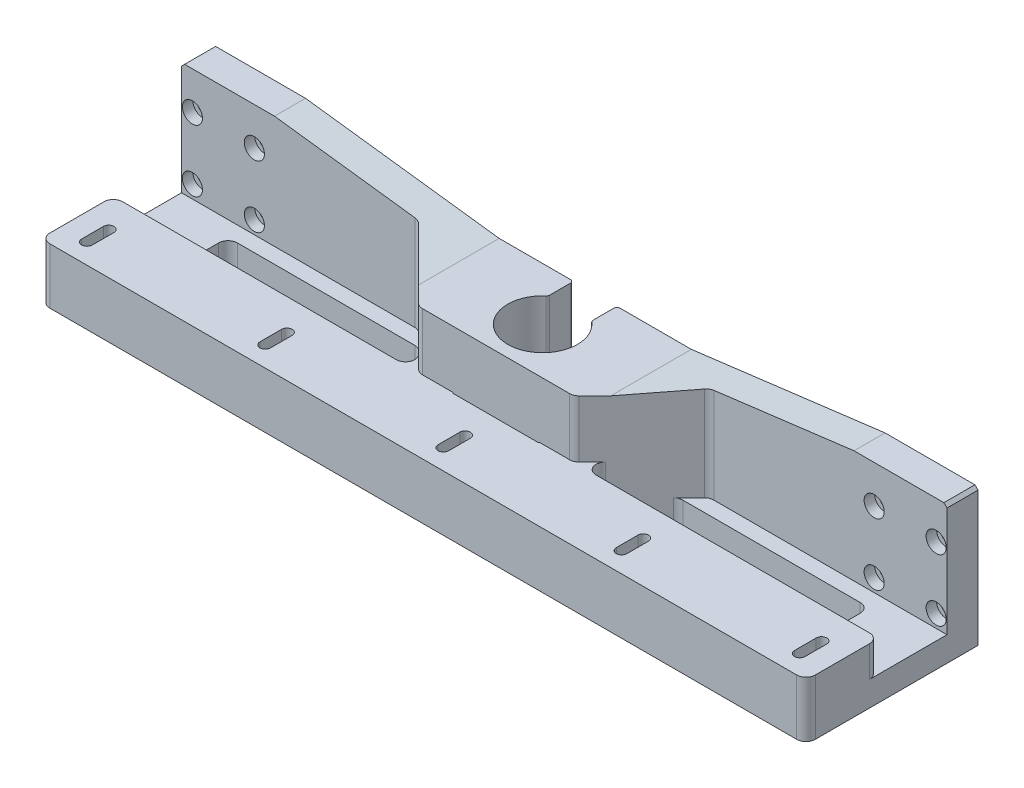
SolidWorks part; units mm, degrees
ref_plane "Ebene vorne" through (0, 0, 0) normal (0, 0, 1) x (1, 0, 0)
ref_plane "Ebene oben" through (0, 0, 0) normal (0, 1, 0) x (1, 0, 0)
ref_plane "Ebene rechts" through (0, 0, 0) normal (1, 0, 0) x (0, 0, -1)
sketch "Skizze1" plane through (0, 0, 0) normal (0, 0, 1) x (1, 0, 0)
  line L1 (-123.5, -22.2) -> (123.5, -22.2)
  line L2 (-123.5, -22.2) -> (-123.5, 22.2)
  line L3 (-123.5, 22.2) -> (123.5, 22.2)
  line L4 (123.5, -22.2) -> (123.5, 22.2)
  line L5 (-123.5, -22.2) -> (123.5, 22.2) construction
  line L6 (-123.5, 22.2) -> (123.5, -22.2) construction
  point P0 (0, 0)
  dimension "D1" = 247
  dimension "D2" = 44.4
extrude "Aufsatz-Linear austragen1" add sketch "Skizze1" along normal blind 55.5
hole_wizard "Ø22.5 (22.5) Durchmesser Bohrung1" positions "Skizze2" profile "Skizze3" hole size "Ø22.5" standard "DIN"
sketch "Skizze2" plane through (0, 22.2, 0) normal (0, 1, 0) x (1, 0, 0)
  point P0 (0, -17)
  dimension "D1" = 17
sketch "Skizze3" plane through (0, 22.2, 17) normal (1, 0, 0) x (0, 0, 1)
  line L0 (0, 0) -> (0, 44.4)
  line L1 (0, 44.4) -> (11.25, 44.4)
  line L2 (11.25, 44.4) -> (11.25, 0)
  line L5 (11.25, 0) -> (0, 0)
  line L11 (0, -6.35) -> (0, 107.95) construction
  dimension "Bohrerdurchmesser" = 22.5
  dimension "Bohrungstiefe" = 44.4
sketch "Skizze4" plane through (0, -22.2, 0) normal (0, 1, 0) x (1, 0, 0)
  line L0 (-13.6999, -1.75) -> (13.6999, -1.75)
  line L1 (-13.6999, -32.25) -> (13.6999, -32.25)
  arc A0 (-13.6999, -1.75) -> (-13.6999, -32.25) centre (0, -17) ccw
  arc A1 (13.6999, -32.25) -> (13.6999, -1.75) centre (0, -17) ccw
  dimension "D1" = 41
  dimension "D2" = 30.5
extrude "Schnitt-Linear austragen1" cut sketch "Skizze4" along normal blind 9.5
sketch "Skizze6" plane through (0, -12.7, 0) normal (0, -1, 0) x (-1, 0, 0)
  line L0 (0, -17) -> (-16, -17) construction
  line L1 (0, -17) -> (16, -17) construction
  circle A0 centre (16, -17) radius 3
  circle A1 centre (-16, -17) radius 3
  dimension "D1" = 6
  dimension "D2" = 32
extrude "Schnitt-Linear austragen3" cut sketch "Skizze6" against normal blind 8
sketch "Skizze7" plane through (0, 22.2, 0) normal (0, 1, 0) x (1, 0, 0)
  line L0 (123.5, -55.5) -> (123.5, 0) construction
  line L1 (-123.5, -55.5) -> (123.5, -55.5)
  line L2 (-123.5, -55.5) -> (-123.5, -10)
  line L3 (-25, -32) -> (25, -32)
  line L4 (123.5, -55.5) -> (123.5, -10)
  line L6 (-123.5, -10) -> (-47, -10)
  line L7 (-123.5, -55.5) -> (-123.5, 0) construction
  line L8 (-47, -10) -> (-25, -32)
  line L9 (123.5, -10) -> (47, -10)
  line L10 (47, -10) -> (25, -32)
  line L11 (123.5, 0) -> (-123.5, 0) construction
  dimension "D1" = 32
  dimension "D2" = 45
  dimension "D3" = 50
  dimension "D4" = 10
extrude "Schnitt-Linear austragen4" cut sketch "Skizze7" against normal offset from surface (36.4 mm away) 8
hole_wizard "Stirnsenkung für M3 Zylinderschraube mit Innensechskant1" positions "Skizze8" profile "Skizze9" counterbore size "M3" standard "DIN"
sketch "Skizze8" plane through (0, 0, 10) normal (0, 0, 1) x (1, 0, 0)
  line L0 (-123.5, -14.2) -> (-123.5, 22.2) construction
  line L1 (-47, 22.2) -> (-123.5, 22.2) construction
  line L2 (123.5, -14.2) -> (123.5, 22.2) construction
  point P0 (-120, 10)
  point P2 (-100, 10)
  point P4 (-100, -10)
  point P6 (-120, -10)
  point P8 (100, 10)
  point P10 (120, 10)
  point P12 (120, -10)
  point P14 (100, -10)
  dimension "D1" = 20
  dimension "D2" = 20
  dimension "D3" = 3.5
  dimension "D4" = 12.2
  dimension "D5" = 3.5
  dimension "D6" = 20
sketch "Skizze9" plane through (-120, 10, 10) normal (1, 0, 0) x (0, -1, 0)
  line L0 (0, 0) -> (0, 10)
  line L1 (0, 10) -> (1.7, 10)
  line L3 (1.7, 10) -> (1.7, 3.4)
  line L4 (1.7, 3.4) -> (3.25, 3.4)
  line L5 (3.25, 3.4) -> (3.25, 0)
  line L7 (3.25, 0) -> (0, 0)
  line L11 (0, -6.35) -> (0, 107.95) construction
  dimension "Bohrerdurchmesser" = 3.4
  dimension "Bohrungstiefe" = 10
  dimension "Senkdurchmesser2" = 6.5
  dimension "Senktiefe2" = 3.4
hole_wizard "Stirnsenkung Langloch für M3 Zylinderschraube mit Innensechskant1" positions "Skizze10" profile "Skizze11" size "M3" standard "DIN"
sketch "Skizze10" plane through (0, -22.2, 0) normal (0, -1, 0) x (-1, 0, 0)
  line L0 (123.5, -55.5) -> (-123.5, -55.5) construction
  line L1 (-115, -49) -> (-115, -42) construction
  point P0 (-115, -45.5)
  point P2 (-57.5, -45.5)
  point P4 (57.5, -45.5)
  point P6 (115, -45.5)
  point P8 (0, -45.5)
  dimension "D1" = 10
  dimension "D2" = 57.5
  dimension "D3" = 57.5
  dimension "D4" = 57.5
  dimension "D5" = 57.5
  dimension "D6" = 7
sketch "Skizze11" plane through (115, -22.2, 45.5) normal (1, 0, 0) x (0, 0, -1)
  line L0 (0, 0) -> (0, 44.4)
  line L1 (0, 44.4) -> (1.7, 44.4)
  line L3 (1.7, 44.4) -> (1.7, 3.4)
  line L4 (1.7, 3.4) -> (3.25, 3.4)
  line L5 (3.25, 3.4) -> (3.25, 0)
  line L7 (3.25, 0) -> (0, 0)
  line L11 (0, -6.35) -> (0, 107.95) construction
  dimension "Bohrerdurchmesser" = 3.4
  dimension "Bohrungstiefe" = 44.4
  dimension "Senkdurchmesser2" = 6.5
  dimension "Senktiefe2" = 3.4
sketch "Skizze12" plane through (0, -14.2, 0) normal (0, 1, 0) x (1, 0, 0)
  line L1 (-103.5, -15) -> (-42, -15)
  line L2 (-103.5, -15) -> (-103.5, -32)
  line L3 (-103.5, -32) -> (-32.2426, -32)
  line L5 (42, -15) -> (103.5, -15)
  line L7 (32.2426, -32) -> (103.5, -32)
  line L8 (103.5, -15) -> (103.5, -32)
  line L9 (-47, -10) -> (-25, -32) construction
  line L10 (-25, -32) -> (-13.9732, -32) construction
  line L11 (-42, -15) -> (-30.1213, -26.8787)
  line L12 (-123.5, -55.5) -> (-123.5, -10) construction
  line L13 (-123.5, -10) -> (-47, -10) construction
  line L14 (25, -32) -> (47, -10) construction
  line L15 (30.1213, -26.8787) -> (42, -15)
  arc A4 (32.2426, -32) -> (30.1213, -26.8787) centre (32.2426, -29) cw
  arc A5 (-30.1213, -26.8787) -> (-32.2426, -32) centre (-32.2426, -29) cw
  dimension "D3" = 3
  dimension "D1" = 20
  dimension "D2" = 5
extrude "Schnitt-Linear austragen5" cut sketch "Skizze12" against normal through all
fillet "Verrundung2" radius 3 6 edges at (103.5, -18.2, 32) (103.5, -18.2, 15) (42, -18.2, 15) (-42, -18.2, 15) (-103.5, -18.2, 32) (-103.5, -18.2, 15)
chamfer "Fase1" distance 1 angle 45 2 edges at (123.5, 22.2, 5) (-123.5, 22.2, 5)
sketch "Skizze13" plane through (0, 0, 32) normal (0, 0, 1) x (1, 0, 0)
  line L0 (-93.5, 22.2) -> (-31, 14.3)
  line L1 (-47, 22.2) -> (-122.5, 22.2) construction
  line L2 (-31, 14.3) -> (31, 14.3)
  line L3 (31, 14.3) -> (93.5, 22.2)
  line L4 (122.5, 22.2) -> (47, 22.2) construction
  line L5 (93.5, 22.2) -> (-93.5, 22.2)
  line L6 (123.5, -14.2) -> (123.5, 21.2) construction
  line L7 (-123.5, -14.2) -> (-123.5, 21.2) construction
  dimension "D1" = 30
  dimension "D2" = 30
  dimension "D3" = 7.9
  dimension "D4" = 62
extrude "Schnitt-Linear austragen6" cut sketch "Skizze13" against normal through all
sketch "Skizze14" plane through (0, -14.2, 0) normal (0, 1, 0) x (1, 0, 0)
  line L0 (-123.5, -55.5) -> (-123.5, -10) construction
  line L1 (116.7, -42) -> (116.7, -49) construction
  line L2 (113.3, -42) -> (113.3, -49) construction
  line L3 (116.7, -42) -> (116.7, -49)
  line L4 (113.3, -42) -> (113.3, -49)
  line L5 (59.2, -42) -> (59.2, -49) construction
  line L6 (55.8, -42) -> (55.8, -49) construction
  line L7 (59.2, -42) -> (59.2, -49)
  line L8 (55.8, -42) -> (55.8, -49)
  line L9 (1.7, -42) -> (1.7, -49) construction
  line L10 (-1.7, -42) -> (-1.7, -49) construction
  line L11 (1.7, -42) -> (1.7, -49)
  line L12 (-1.7, -42) -> (-1.7, -49)
  line L13 (-55.8, -42) -> (-55.8, -49) construction
  line L14 (-59.2, -42) -> (-59.2, -49) construction
  line L15 (-55.8, -42) -> (-55.8, -49)
  line L16 (-41.1213, -15.8787) -> (-47, -10)
  line L17 (-47, -10) -> (-123.5, -10)
  line L18 (-123.5, -10) -> (-123.5, -55.5)
  line L19 (-123.5, -55.5) -> (123.5, -55.5)
  line L20 (123.5, -55.5) -> (123.5, -10)
  line L21 (123.5, -10) -> (47, -10)
  line L22 (47, -10) -> (41.1213, -15.8787)
  line L23 (43.2426, -15) -> (100.5, -15)
  line L24 (103.5, -18) -> (103.5, -29)
  line L25 (100.5, -32) -> (32.2426, -32)
  line L26 (30.1213, -26.8787) -> (25, -32)
  line L27 (25, -32) -> (13.9732, -32)
  line L28 (-25, -32) -> (-30.1213, -26.8787)
  line L29 (-32.2426, -32) -> (-100.5, -32)
  line L30 (-103.5, -29) -> (-103.5, -18)
  line L31 (-100.5, -15) -> (-43.2426, -15)
  line L34 (-123.5, -35) -> (-123.5, -55.5)
  line L35 (-123.5, -55.5) -> (123.5, -55.5)
  line L36 (123.5, -55.5) -> (123.5, -35)
  line L41 (120.5, -32) -> (32.2426, -32)
  line L42 (30.1213, -26.8787) -> (25, -32)
  line L44 (-25, -32) -> (-30.1213, -26.8787)
  line L45 (-32.2426, -32) -> (-120.5, -32)
  line L47 (-59.2, -42) -> (-59.2, -49)
  line L48 (-113.3, -42) -> (-113.3, -49) construction
  line L49 (-116.7, -42) -> (-116.7, -49) construction
  line L50 (-113.3, -42) -> (-113.3, -49)
  line L51 (-116.7, -42) -> (-116.7, -49)
  line L70 (25, -32) -> (13.9732, -32)
  line L71 (13.6999, -32.25) -> (-13.6999, -32.25)
  line L72 (13.6999, -32.25) -> (-13.6999, -32.25)
  line L73 (-13.9732, -32) -> (-25, -32)
  line L74 (-13.9732, -32) -> (-25, -32)
  arc A10 (-120.5, -32) -> (-123.5, -35) centre (-120.5, -35) ccw
  arc A11 (123.5, -35) -> (120.5, -32) centre (120.5, -35) ccw
  arc A12 (113.3, -49) -> (116.7, -49) centre (115, -49) ccw construction
  arc A13 (116.7, -42) -> (113.3, -42) centre (115, -42) ccw construction
  arc A15 (113.3, -49) -> (116.7, -49) centre (115, -49) ccw
  arc A16 (116.7, -42) -> (113.3, -42) centre (115, -42) ccw
  arc A18 (43.2426, -15) -> (41.1213, -15.8787) centre (43.2426, -18) ccw
  arc A19 (103.5, -18) -> (100.5, -15) centre (100.5, -18) ccw
  arc A20 (100.5, -32) -> (103.5, -29) centre (100.5, -29) ccw
  arc A21 (30.1213, -26.8787) -> (32.2426, -32) centre (32.2426, -29) ccw
  arc A22 (59.2, -42) -> (55.8, -42) centre (57.5, -42) ccw construction
  arc A23 (55.8, -49) -> (59.2, -49) centre (57.5, -49) ccw construction
  arc A24 (-32.2426, -32) -> (-30.1213, -26.8787) centre (-32.2426, -29) ccw
  arc A25 (-103.5, -29) -> (-100.5, -32) centre (-100.5, -29) ccw
  arc A26 (-100.5, -15) -> (-103.5, -18) centre (-100.5, -18) ccw
  arc A27 (-41.1213, -15.8787) -> (-43.2426, -15) centre (-43.2426, -18) ccw
  arc A35 (30.1213, -26.8787) -> (32.2426, -32) centre (32.2426, -29) ccw
  arc A38 (-32.2426, -32) -> (-30.1213, -26.8787) centre (-32.2426, -29) ccw
  arc A41 (59.2, -42) -> (55.8, -42) centre (57.5, -42) ccw
  arc A42 (55.8, -49) -> (59.2, -49) centre (57.5, -49) ccw
  arc A43 (-1.7, -49) -> (1.7, -49) centre (0, -49) ccw construction
  arc A44 (1.7, -42) -> (-1.7, -42) centre (0, -42) ccw construction
  arc A45 (-1.7, -49) -> (1.7, -49) centre (0, -49) ccw
  arc A46 (1.7, -42) -> (-1.7, -42) centre (0, -42) ccw
  arc A47 (-59.2, -49) -> (-55.8, -49) centre (-57.5, -49) ccw construction
  arc A48 (-55.8, -42) -> (-59.2, -42) centre (-57.5, -42) ccw construction
  arc A49 (-59.2, -49) -> (-55.8, -49) centre (-57.5, -49) ccw
  arc A50 (-55.8, -42) -> (-59.2, -42) centre (-57.5, -42) ccw
  arc A51 (-116.7, -49) -> (-113.3, -49) centre (-115, -49) ccw construction
  arc A52 (-113.3, -42) -> (-116.7, -42) centre (-115, -42) ccw construction
  arc A53 (-116.7, -49) -> (-113.3, -49) centre (-115, -49) ccw
  arc A54 (-113.3, -42) -> (-116.7, -42) centre (-115, -42) ccw
  arc A65 (13.6999, -32.25) -> (13.9732, -32) centre (0, -17) ccw
  arc A66 (13.6999, -32.25) -> (13.9732, -32) centre (0, -17) ccw
  arc A67 (-13.9732, -32) -> (-13.6999, -32.25) centre (0, -17) ccw
  arc A68 (-13.9732, -32) -> (-13.6999, -32.25) centre (0, -17) ccw
  point P64 (-123.5, -32)
  dimension "D2" = 3
  dimension "D1" = 0
extrude "Aufsatz-Linear austragen2" add sketch "Skizze14" along normal blind 10
sketch "Skizze15" plane through (0, 14.3, 0) normal (0, 1, 0) x (1, 0, 0)
  line L0 (-31, 0) -> (31, 0) construction
  line L1 (-7, 0) -> (7, 0)
  line L2 (-7, 0) -> (-7, -12)
  line L3 (-7, -12) -> (7, -12)
  line L4 (7, 0) -> (7, -12)
  point P6 (0, 0)
  dimension "D1" = 14
  dimension "D2" = 12
extrude "Schnitt-Linear austragen7" cut sketch "Skizze15" against normal through all
fillet "Verrundung1" radius 3 6 edges at (-47, 1.0612, 10) (47, 1.0612, 10) (-25, 5.05, 32) (25, 5.05, 32) (-123.5, -13.2, 55.5) (123.5, -13.2, 55.5)
sketch "Skizze16" plane through (0, -22.2, 0) normal (0, -1, 0) x (1, 0, 0)
  line L0 (-13.6999, 1.75) -> (13.6999, 1.75)
  arc A0 (13.6999, 1.75) -> (13.6999, 32.25) centre (0, 17) ccw construction
  arc A1 (-13.6999, 1.75) -> (13.6999, 1.75) centre (0, 17) ccw
extrude "Schnitt-Linear austragen8" cut sketch "Skizze16" against normal up to surface (9.5 mm away)
fillet "Verrundung3" radius 1 6 edges at (-7, 0.8, 8.193) (7, 0.8, 8.193) (-11.4564, -17.45, 0) (11.4564, -17.45, 0) (7, 0.8, 0) (-7, 0.8, 0)
